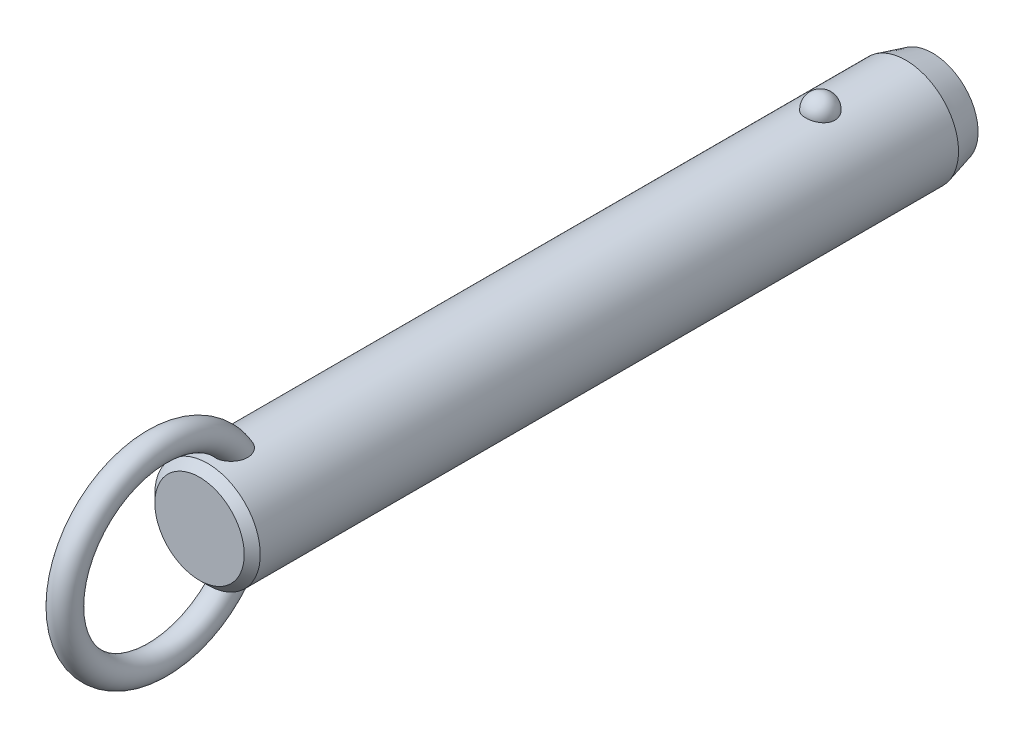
SolidWorks part; units mm, degrees
ref_plane "Front Plane" through (0, 0, 0) normal (0, 0, 1) x (1, 0, 0)
ref_plane "Top Plane" through (0, 0, 0) normal (0, 1, 0) x (1, 0, 0)
ref_plane "Right Plane" through (0, 0, 0) normal (1, 0, 0) x (0, 0, -1)
sketch "Sketch2" plane through (0, 0, 0) normal (0, 0, 1) x (1, 0, 0)
  circle A0 centre (0, 0) radius 7.9
  point P3 (0, 7.9)
  dimension "D1" = 15.8
extrude "Boss-Extrude1" add sketch "Sketch2" along normal blind 81.3
sketch "Sketch3" plane through (0, 0, 0) normal (0, 0, -1) x (-1, 0, 0)
  circle A0 centre (0, 0) radius 7.9
  dimension "D1" = 15.8
extrude "Boss-Extrude2" add sketch "Sketch3" along normal blind 19
chamfer "Chamfer1" distance 4 angle 15 1 edges at (-7.9, 0, -19)
sketch "Sketch12" plane through (0, 0, 0) normal (1, 0, 0) x (0, 0, -1)
  line L0 (-81.3, 7.9) -> (-81.3, -7.9) construction
  point P0 (-81.3, 0)
sketch "Sketch13" plane through (0, 0, 0) normal (1, 0, 0) x (0, 0, -1)
  circle A0 centre (-97.15, 0) radius 15.85
  point P2 (-81.3, 0)
  dimension "D1" = 31.7
sketch "Sketch14" plane through (0, 0, 0) normal (0, 1, 0) x (1, 0, 0)
  circle A0 centre (0, -83.3) radius 2
  point P2 (0, -81.3)
  dimension "D1" = 4
sweep "Sweep1" add profiles "Sketch14" path "Sketch13"
sketch "Sketch15" plane through (0, 0, 81.3) normal (0, 0, 1) x (1, 0, 0)
  circle A0 centre (0, 0) radius 7.9
  dimension "D1" = 15.8
extrude "Boss-Extrude3" add sketch "Sketch15" along normal blind 9.52
chamfer "Chamfer2" distance 1.2 angle 45 1 edges at (7.9, 0, 90.82)
sketch "Sketch18" plane through (0, 0, 0) normal (1, 0, 0) x (0, 0, -1)
  line L0 (15, 7.9) -> (-83.4091, 7.9) construction
  line L1 (2.2, 10.1) -> (2.2, 5.7)
  line L2 (-83.4091, -7.9) -> (15, -7.9) construction
  arc A0 (2.2, 10.1) -> (2.2, 5.7) centre (2.2, 7.9) ccw
  point P4 (0, 7.9)
  dimension "D1" = 18
revolve "Revolve1" add sketch "Sketch18" angle 360 about L1
